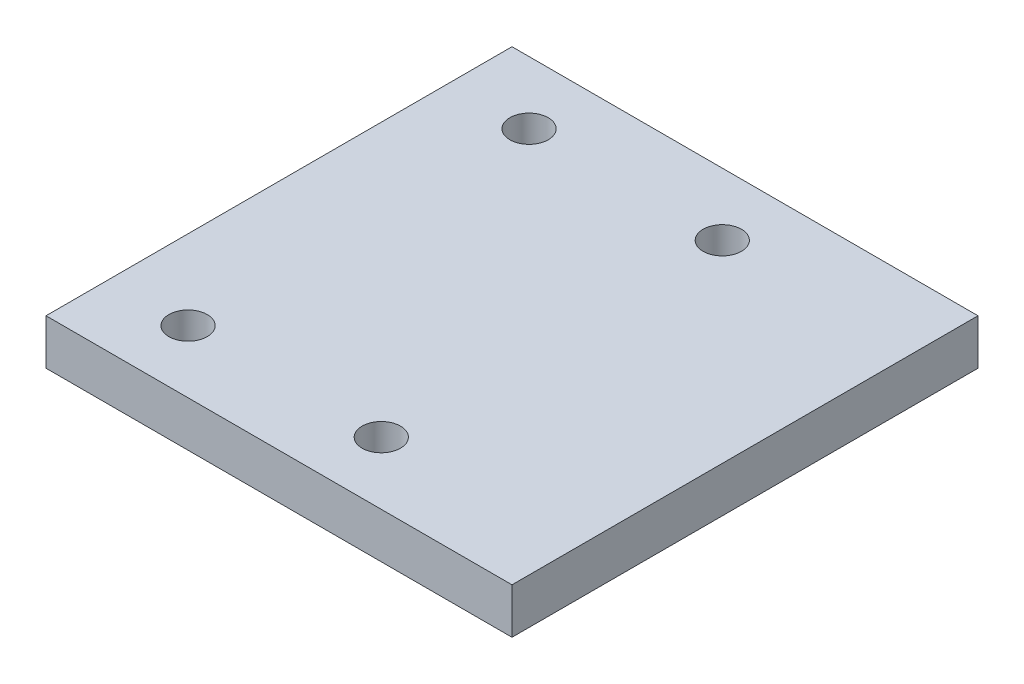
SolidWorks part; units mm, degrees
ref_plane "Face" through (0, 0, 0) normal (0, 0, 1) x (1, 0, 0)
ref_plane "Dessus" through (0, 0, 0) normal (0, 1, 0) x (1, 0, 0)
ref_plane "Droite" through (0, 0, 0) normal (1, 0, 0) x (0, 0, -1)
sketch "Esquisse1" plane through (0, 0, 0) normal (0, 0, 1) x (1, 0, 0)
  line L1 (-41, 0) -> (41, 0)
  line L2 (-41, 0) -> (-41, 8)
  line L3 (-41, 8) -> (41, 8)
  line L4 (41, 0) -> (41, 8)
  dimension "D1" = 82
  dimension "D2" = 8
extrude "Extrusion1" add sketch "Esquisse1" along normal mid plane 82
sketch "Esquisse2" plane through (0, 8, 0) normal (0, 1, 0) x (1, 0, 0)
  line L0 (41, -41) -> (41, 41) construction
  line L1 (0, 0) -> (53.1116, 0) construction
  circle A0 centre (-27, 30) radius 3.375
  circle A1 centre (7, 30) radius 3.375
  circle A2 centre (7, -30) radius 3.375
  circle A3 centre (-27, -30) radius 3.375
  dimension "D1" = 6.75
  dimension "D2" = 68
  dimension "D3" = 30
  dimension "D4" = 34
extrude "Enlèv. mat.-Extru.1" cut sketch "Esquisse2" against normal through all
